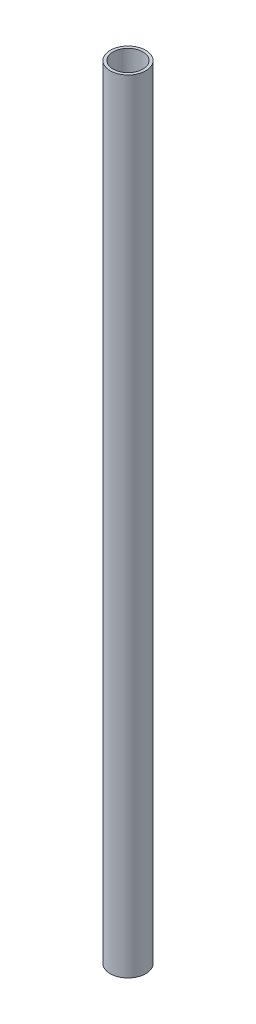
SolidWorks part; units mm, degrees
ref_plane "Front Plane" through (0, 0, 0) normal (0, 0, 1) x (1, 0, 0)
ref_plane "Top Plane" through (0, 0, 0) normal (0, 1, 0) x (1, 0, 0)
ref_plane "Right Plane" through (0, 0, 0) normal (1, 0, 0) x (0, 0, -1)
sketch "Sketch1" plane through (0, 0, 0) normal (0, 1, 0) x (1, 0, 0)
  circle A0 centre (0, 0) radius 12.5
  circle A1 centre (0, 0) radius 10.5
  dimension "D1" = 25
  dimension "D2" = 2
sketch "Sketch3" plane through (0, 0, 0) normal (0, 0, 1) x (1, 0, 0)
  line L0 (0, 0) -> (0, 550)
  dimension "D1" = 550
extrude "Boss-Extrude1" add sketch "Sketch1" along normal up to vertex (550 mm away)
